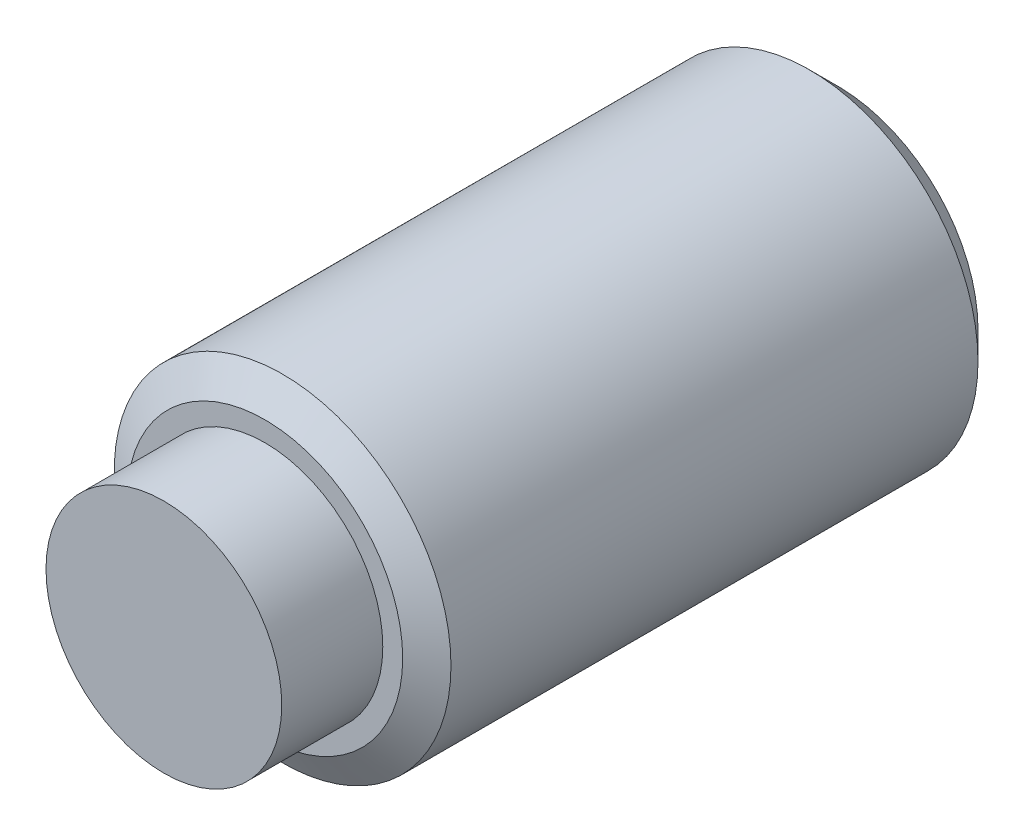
SolidWorks part; units mm, degrees
ref_plane "Plane1" through (0, 0, 0) normal (0, 0, 1) x (1, 0, 0)
ref_plane "Plane2" through (0, 0, 0) normal (0, 1, 0) x (1, 0, 0)
ref_plane "Plane3" through (0, 0, 0) normal (1, 0, 0) x (0, 0, -1)
sketch "Sketch1" plane through (0, 0, 0) normal (0, 0, 1) x (1, 0, 0)
  circle A0 centre (0, 0) radius 2.5
extrude "Shank" add sketch "Sketch1" along normal blind 10
sketch "Sketch7" plane through (-1.0138, 4.1287, 0) normal (0, 0, -1) x (-1, 0, 0)
  line L0 (-1.0138, -10.5903) -> (-1.0138, -0.4303) construction
  line L1 (23.7378, -4.1287) -> (-28.2854, -4.1287) construction
  line L2 (-2.2738, -4.8561) -> (-2.2738, -3.4012)
  line L3 (-1.0138, -2.6738) -> (-2.2738, -3.4012)
  line L4 (-1.0138, -2.6738) -> (0.2462, -3.4012)
  line L5 (0.2462, -4.8561) -> (0.2462, -3.4012)
  line L6 (-1.0138, -5.5836) -> (-2.2738, -4.8561)
  line L7 (-1.0138, -5.5836) -> (0.2462, -4.8561)
  point P8 (-2.2738, -4.1287)
extrude "Hex" cut sketch "Sketch7" against normal blind 1.27
chamfer "Chamfer1" distance 0.4133 angle 45 1 edges at (2.5, 0, 0)
sketch "Sketch8" plane through (0, 0, 10) normal (0, 0, 1) x (1, 0, 0)
  circle A0 centre (0, 0) radius 1.75
  circle A1 centre (0, 0) radius 6.225
  dimension "D1" = 3.5
extrude "Dog Point" cut sketch "Sketch8" against normal blind 1.5
chamfer "Chamfer2" distance 0.2625 angle 60 1 edges at (2.5, 0, 8.5)
equation "\"D1@Chamfer1\" = (\"ThreadDia@Sketch1\"-\"HexWidth@Sketch7\")/6"
